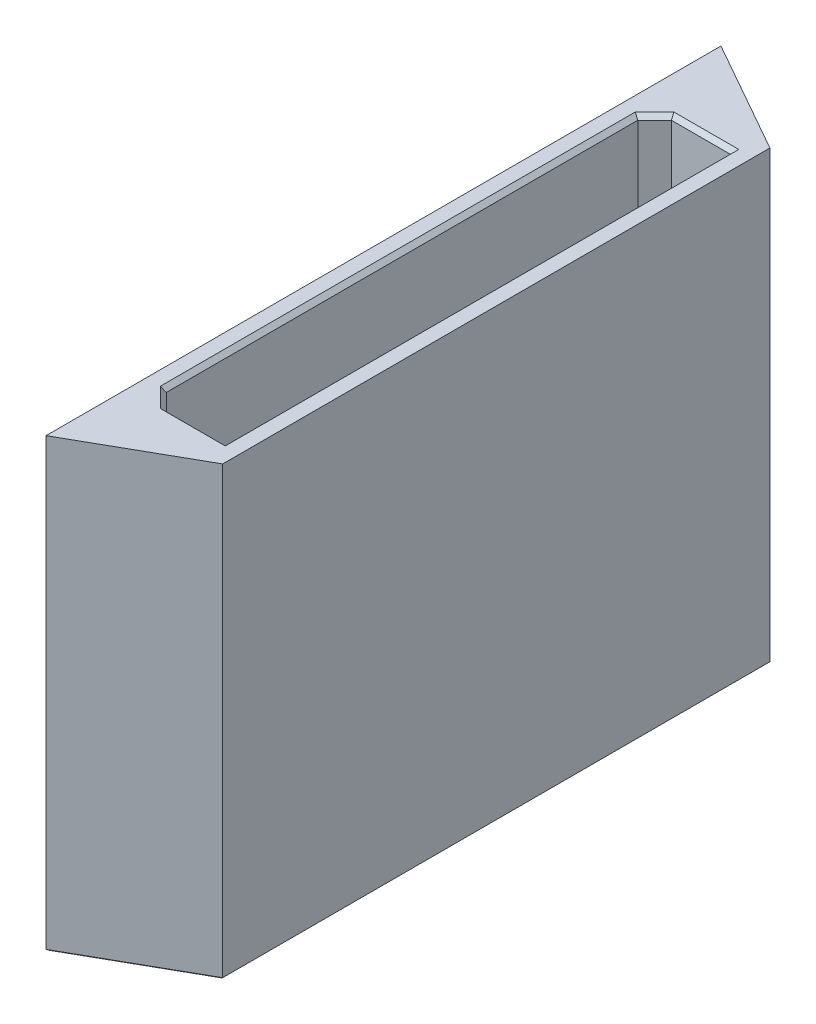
SolidWorks part; units mm, degrees
ref_plane "Front Plane" through (0, 0, 0) normal (0, 0, 1) x (1, 0, 0)
ref_plane "Top Plane" through (0, 0, 0) normal (0, 1, 0) x (1, 0, 0)
ref_plane "Right Plane" through (0, 0, 0) normal (1, 0, 0) x (0, 0, -1)
sketch "Sketch2" plane through (0, 0, 0) normal (0, 1, 0) x (1, 0, 0)
  line L0 (0, 0) -> (0, 160.3254)
  line L1 (0, 160.3254) -> (26.8, 145.1627)
  line L2 (26.8, 145.1627) -> (26.8, 15.1627)
  line L3 (26.8, 15.1627) -> (0, 0)
  dimension "D1" = 60.5
  dimension "D2" = 60.5
  dimension "D3" = 130
  dimension "D4" = 26.8
extrude "Boss-Extrude1" add sketch "Sketch2" along normal blind 106
sketch "Sketch3" plane through (0, 106, 0) normal (0, 1, 0) x (1, 0, 0)
  line L0 (26.8, 80.1627) -> (0, 80.1627) construction
  line L1 (26.8, 15.1627) -> (26.8, 145.1627) construction
  line L2 (0, 160.3254) -> (0, 0) construction
  line L4 (4.4, 27.1627) -> (22.4, 27.1627)
  line L5 (4.4, 27.1627) -> (4.4, 133.1627)
  line L6 (4.4, 133.1627) -> (22.4, 133.1627)
  line L7 (22.4, 27.1627) -> (22.4, 133.1627)
  line L8 (4.4, 27.1627) -> (22.4, 133.1627) construction
  line L9 (4.4, 133.1627) -> (22.4, 27.1627) construction
  point P6 (13.4, 80.1627)
  dimension "D1" = 18
  dimension "D2" = 106
extrude "Cut-Extrude1" cut sketch "Sketch3" against normal offset from surface (46.9521 mm away) 24.2
sketch "Sketch4" plane through (0, 106, 0) normal (0, 1, 0) x (1, 0, 0)
  line L0 (4.4, 80.1627) -> (22.4, 80.1627) construction
  line L1 (4.4, 133.1627) -> (4.4, 27.1627) construction
  line L2 (22.4, 27.1627) -> (22.4, 133.1627) construction
  line L4 (22.4, 20.1627) -> (4.4, 20.1627)
  line L5 (22.4, 20.1627) -> (22.4, 140.1627)
  line L6 (22.4, 140.1627) -> (4.4, 140.1627)
  line L7 (4.4, 20.1627) -> (4.4, 140.1627)
  line L8 (22.4, 20.1627) -> (4.4, 140.1627) construction
  line L9 (22.4, 140.1627) -> (4.4, 20.1627) construction
  point P6 (13.4, 80.1627)
  dimension "D1" = 120
extrude "Cut-Extrude2" cut sketch "Sketch4" against normal offset from surface (56.8 mm away) 25
sketch "Sketch5" plane through (0, 24.2, 0) normal (0, 1, 0) x (1, 0, 0)
  line L1 (6.9221, 97.1627) -> (14.0221, 97.1627)
  line L2 (6.9221, 97.1627) -> (6.9221, 53.5627)
  line L3 (6.9221, 53.5627) -> (14.0221, 53.5627)
  line L4 (14.0221, 97.1627) -> (14.0221, 53.5627)
  line L14 (13.7221, 96.8627) -> (7.2221, 96.8627) construction
  line L15 (7.2221, 53.8627) -> (13.7221, 53.8627) construction
  line L16 (7.2221, 96.8627) -> (7.2221, 53.8627) construction
  line L17 (13.7221, 53.8627) -> (13.7221, 96.8627) construction
  dimension "D1" = 0.3
  dimension "D2" = 0.3
  dimension "D3" = 0.3
  dimension "D4" = 0.3
extrude "Cut-Extrude3" cut sketch "Sketch5" against normal blind 10.7
sketch "Sketch6" plane through (0, 0, 0) normal (-1, 0, 0) x (0, 0, 1)
  line L0 (-15.1627, 0) -> (-145.1627, 0) construction
  line L1 (-93.2627, 3) -> (-58.2127, 3)
  line L2 (-93.2627, 3) -> (-93.2627, 13.5)
  line L3 (-93.2627, 13.5) -> (-58.2127, 13.5)
  line L4 (-58.2127, 3) -> (-58.2127, 13.5)
  line L5 (-53.5627, 13.5) -> (-97.1627, 13.5) construction
  line L6 (-58.6127, 11.6) -> (-58.6127, 13.6) construction
  line L7 (-92.8627, 7.6) -> (-92.8627, 13.6) construction
  dimension "D1" = 3
  dimension "D2" = 0.4
  dimension "D3" = 0.4
extrude "Cut-Extrude4" cut sketch "Sketch6" against normal blind 13
sketch "Sketch7" plane through (0, 0, 0) normal (-1, 0, 0) x (0, 0, 1)
  line L1 (-58.2127, 10) -> (-5, 10)
  line L2 (-58.2127, 10) -> (-58.2127, 3)
  line L3 (-58.2127, 3) -> (-5, 3)
  line L4 (-5, 10) -> (-5, 3)
  line L5 (0, 106) -> (0, 0) construction
  line L6 (-93.2627, 3) -> (-58.2127, 3) construction
  line L7 (-58.2127, 3) -> (-58.2127, 13.5) construction
  dimension "D1" = 5
  dimension "D2" = 7
extrude "Cut-Extrude6" cut sketch "Sketch7" against normal blind 6
chamfer "Chamfer1" distance 6 angle 45 1 edges at (6, 6.5, -5)
chamfer "Chamfer2" distance 6 angle 45 1 edges at (6, 6.5, -58.2127)
chamfer "Chamfer3" distance 3.5 distance2 6 1 edges at (0, 10, -31.6064)
chamfer "Chamfer5" distance 4 angle 45 2 edges at (4.4, 77.6, -20.1627) (4.4, 77.6, -140.1627)
chamfer "Chamfer6" distance 2 angle 45 2 edges at (13.4, 49.2, -133.1627) (13.4, 49.2, -27.1627)
chamfer "Chamfer7" distance 1 angle 45 6 edges at (15.4, 106, -140.1627) (6.4, 106, -138.1627) (4.4, 106, -80.1627) (6.4, 106, -22.1627) (15.4, 106, -20.1627) (22.4, 106, -80.1627)
sketch "Sketch8" plane through (0, 0, 0) normal (-1, 0, 0) x (0, 0, 1)
  line L0 (-10, 106) -> (-10, 0) construction
  line L1 (-160.3254, 106) -> (0, 106) construction
  line L2 (-160.3254, 0) -> (0, 0) construction
  line L3 (0, 106) -> (0, 0) construction
  line L4 (-122, 106) -> (-122, 0) construction
  line L5 (-160.3254, 106) -> (-160.3254, 0) construction
  line L6 (-58.2127, 13.5) -> (-5, 13.5) construction
  circle A0 centre (-10, 96) radius 1.1
  circle A1 centre (-10, 23.5) radius 1.1
  circle A2 centre (-150.3254, 23.5) radius 1.1
  circle A3 centre (-150.3254, 96) radius 1.1
  circle A4 centre (-10, 86) radius 1.1
  circle A5 centre (-150.3254, 71) radius 1.1
  dimension "D3" = 10
  dimension "D4" = 10
  dimension "D5" = 2.2
  dimension "D6" = 10
  dimension "D7" = 10
  dimension "D8" = 10
  dimension "D9" = 10
  dimension "D10" = 10
  dimension "D11" = 10
  dimension "D12" = 25
  dimension "D1" = 10
  dimension "D2" = 122
extrude "Cut-Extrude7" cut sketch "Sketch8" against normal blind 10
chamfer "Chamfer9" distance 0.5 angle 45 6 edges at (0, 96, -8.9) (0, 23.5, -8.9) (0, 96, -149.2254) (0, 23.5, -149.2254) (0, 86, -8.9) (0, 71, -149.2254)
sketch "Sketch9" plane through (0, 0, 0) normal (-1, 0, 0) x (0, 0, 1)
  line L1 (-97.1627, 13.5) -> (-93.2627, 13.5) construction
  line L2 (-97.1627, 13.5) -> (-97.1627, 24.2) construction
  line L3 (-58.2127, 13.5) -> (-53.5627, 13.5) construction
  line L4 (-53.5627, 13.5) -> (-53.5627, 24.2) construction
  circle A0 centre (-95.1627, 17.5) radius 0.5
  circle A1 centre (-55.5627, 17.5) radius 0.5
  dimension "D1" = 1
  dimension "D2" = 4
  dimension "D3" = 2
  dimension "D4" = 4
  dimension "D5" = 2
extrude "Cut-Extrude8" cut sketch "Sketch9" against normal offset from surface (23.8 mm away) 3
chamfer "Chamfer10" distance 0.5 angle 45 2 edges at (0, 17.5, -55.0627) (0, 17.5, -94.6627)
chamfer "Chamfer11" distance 1 angle 45 4 edges at (14.0221, 24.2, -75.3627) (10.4721, 24.2, -97.1627) (10.4721, 24.2, -53.5627) (6.9221, 24.2, -75.3627)
ref_plane "Plane1" through (-0.8671, -2.9729, -0.8671) normal (0.2696, 0.9244, 0.2696) x (0.9611, -0.2412, -0.1343)
sketch "Sketch10" plane through (-0.8671, -2.9729, -0.8671) normal (0.2696, 0.9244, 0.2696) x (0.9611, -0.2412, -0.1343)
  line L0 (10.3673, 52.3865) -> (16.94, 57.7531)
  line L1 (16.94, 57.7531) -> (4.5621, 59.4963)
  line L2 (4.5621, 59.4963) -> (10.3673, 52.3865)
extrude "Cut-Extrude9" cut sketch "Sketch10" against normal up to vertex
sketch "Sketch11" plane through (0, 0, 0) normal (-1, 0, 0) x (0, 0, 1)
  line L0 (-15, 3) -> (-15, 28.5)
  line L1 (-93.2627, 3) -> (-5, 3) construction
  line L2 (-15, 28.5) -> (-5, 28.5)
  line L3 (-5, 28.5) -> (-5, 81)
  line L4 (-5, 81) -> (-30, 81)
  line L5 (-30, 81) -> (-30, 3)
  line L6 (-30, 3) -> (-15, 3)
  line L7 (-5, 3) -> (-5, 13.5) construction
  circle A0 centre (-10, 23.5) radius 1.1 construction
  circle A1 centre (-10, 86) radius 1.1 construction
  dimension "D1" = 15
  dimension "D2" = 5
  dimension "D3" = 5
  dimension "D4" = 5
extrude "Cut-Extrude10" cut sketch "Sketch11" against normal offset from surface (3.6 mm away) 0.8
chamfer "Chamfer12" distance 4 angle 45 1 edges at (3.6, 81, -17.5)
chamfer "Chamfer13" distance 4 angle 45 1 edges at (3.6, 52.75, -5)
sketch "Sketch14" plane through (0, 13.5, 0) normal (0, 1, 0) x (1, 0, 0)
  line L0 (13, 58.2127) -> (13, 93.2627) construction
  line L1 (13, 90.2627) -> (14.0221, 90.2627)
  line L2 (13, 90.2627) -> (13, 61.2127)
  line L3 (13, 61.2127) -> (14.0221, 61.2127)
  line L4 (14.0221, 90.2627) -> (14.0221, 61.2127)
  line L5 (14.0221, 53.5627) -> (14.0221, 97.1627) construction
  line L6 (13, 93.2627) -> (6.9221, 93.2627) construction
  line L7 (13, 58.2127) -> (6.9221, 58.2127) construction
  dimension "D1" = 3
  dimension "D2" = 3
extrude "Cut-Extrude19" cut sketch "Sketch14" against normal up to surface (10.5 mm away)
sketch "Sketch15" plane through (0, 0, 0) normal (-1, 0, 0) x (0, 0, 1)
  line L0 (-75.7377, 13.5) -> (-75.7377, 31.025) construction
  line L1 (-58.2127, 13.5) -> (-93.2627, 13.5) construction
  line L2 (-75.7377, 31.025) -> (-93.2627, 13.5)
  line L3 (-75.7377, 31.025) -> (-58.2127, 13.5)
  line L4 (-58.2127, 13.5) -> (-93.2627, 13.5)
  line L5 (-93.2627, 13.5) -> (-93.2627, 3) construction
  dimension "D1" = 90
extrude "Cut-Extrude20" cut sketch "Sketch15" against normal up to surface (14.0221 mm away)
chamfer "Chamfer14" distance 0.3 angle 45 4 edges at (26.8, 0, -80.1627) (13.4, 0, -152.7441) (0, 0, -80.1627) (13.4, 0, -7.5814)
equation "\"D1@Sketch2\" = \"D2@Sketch2\""
equation "\"D2@Sketch5\"=\"D1@Sketch5\""
equation "\"D3@Sketch5\"=\"D1@Sketch5\""
equation "\"D4@Sketch5\"=\"D3@Sketch5\""
equation "\"D11@Sketch8\"=\"D8@Sketch8\""
equation "\"D3@Sketch11\"=\"D2@Sketch11\""
equation "\"D4@Sketch11\"=\"D3@Sketch11\""
equation "\"D2@Sketch14\"=\"D1@Sketch14\""
